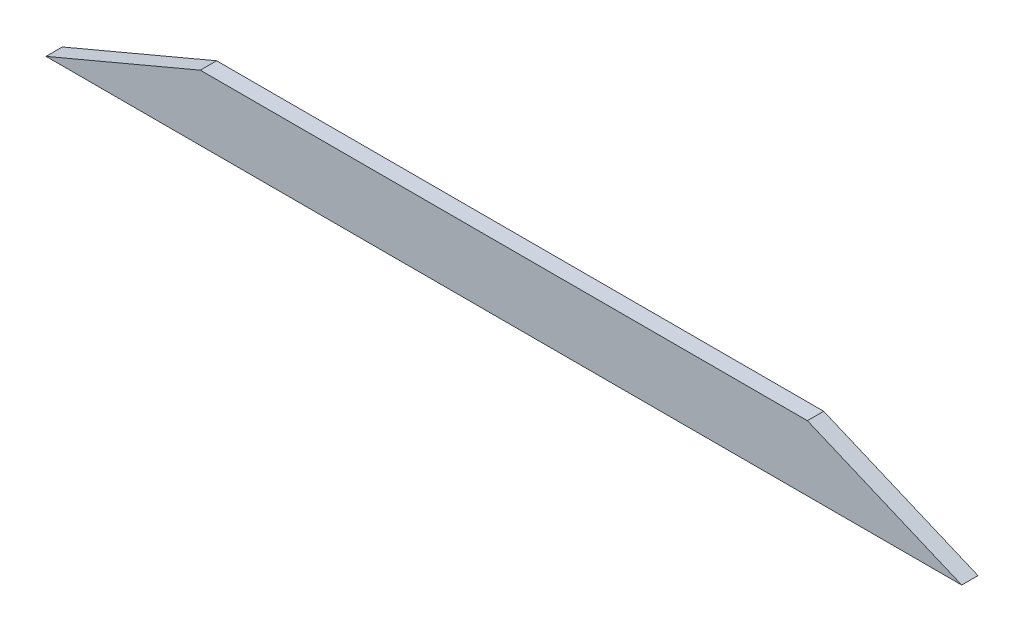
SolidWorks part; units mm, degrees
ref_plane "Front Plane" through (0, 0, 0) normal (0, 0, 1) x (1, 0, 0)
ref_plane "Top Plane" through (0, 0, 0) normal (0, 1, 0) x (1, 0, 0)
ref_plane "Right Plane" through (0, 0, 0) normal (1, 0, 0) x (0, 0, -1)
sketch "Sketch1" plane through (0, 0, 0) normal (0, 0, 1) x (1, 0, 0)
  line L0 (0, -50.8) -> (0, -2032) construction
  line L1 (-473.0229, 50.8) -> (473.0229, 50.8)
  line L3 (-713.4762, -50.8) -> (713.4762, -50.8)
  line L5 (-812.8, 50.8) -> (812.8, -50.8) construction
  line L6 (-812.8, -50.8) -> (812.8, 50.8) construction
  line L7 (-1219.2, -2032) -> (1219.2, -2032) construction
  line L8 (-914.4, -50.8) -> (914.4, -50.8) construction
  line L9 (-1219.2, -2032) -> (-914.4, -50.8) construction
  line L10 (-1116.4047, -2032) -> (-811.6047, -50.8) construction
  line L11 (-1118.7814, -2047.449) -> (-813.9814, -66.249) construction
  line L12 (0, -50.8) -> (0, 355.6) construction
  line L13 (-12.7, -50.8) -> (-12.7, 355.6) construction
  line L14 (-914.4, -25.4) -> (-12.7, 355.6) construction
  line L15 (-914.4, -50.8) -> (-812.8, -50.8) construction
  line L16 (-914.4, -50.8) -> (-914.4, -25.4) construction
  line L17 (-914.4, -25.4) -> (-812.8, -25.4) construction
  line L19 (-818.427, -95.1454) -> (-12.7, 245.3026) construction
  line L20 (-914.4, -25.4) -> (-812.8, -25.4) construction
  line L21 (-812.8, -25.4) -> (-812.8, -50.8) construction
  line L22 (-874.8556, -118.9885) -> (26.8444, 262.0115) construction
  line L23 (-812.8, -50.8) -> (-811.6047, -50.8) construction
  line L24 (-811.6047, -50.8) -> (-818.427, -95.1454) construction
  line L25 (-12.7, 355.6) -> (-12.7, 245.3026) construction
  line L26 (-713.4762, -50.8) -> (-473.0229, 50.8)
  line L27 (713.4762, -50.8) -> (473.0229, 50.8)
  point P0 (0, 0)
  point P11 (0, -2032)
  point P13 (0, -50.8)
  dimension "D1" = 101.6
  dimension "D2" = 1625.6
  dimension "D3" = 1981.2
  dimension "D4" = 2438.4
  dimension "D5" = 1828.8
  dimension "D7" = 406.4
  dimension "D9" = 25.4
  dimension "D10" = 101.6
  dimension "D6" = 101.6
  dimension "D8" = 12.7
  dimension "D11" = 101.6
extrude "Boss-Extrude1" add sketch "Sketch1" along normal blind 25.4
